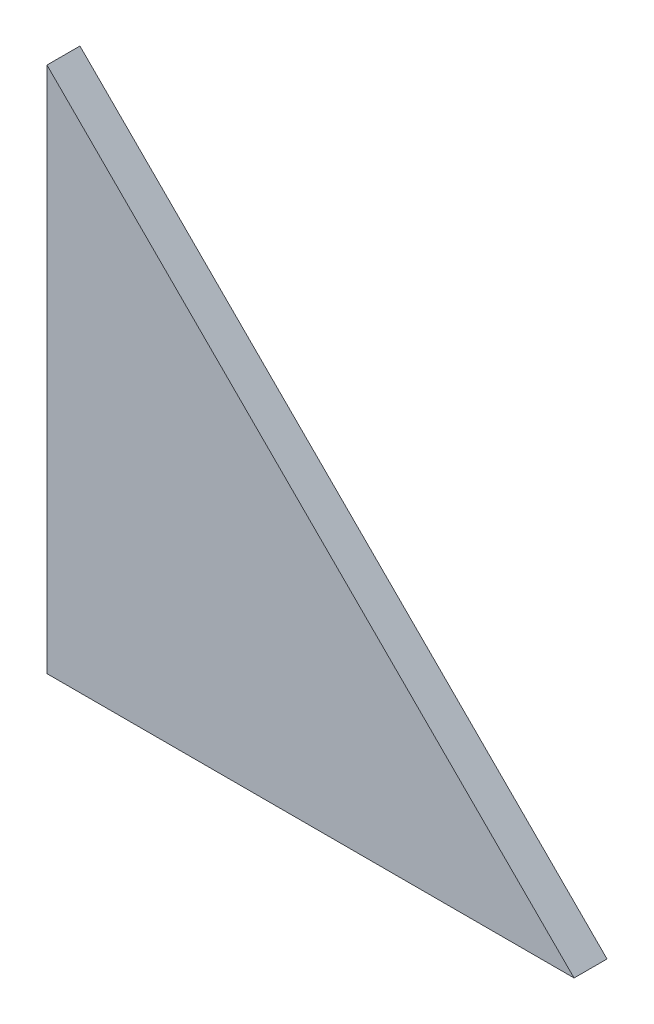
SolidWorks part; units mm, degrees
ref_plane "Front Plane" through (0, 0, 0) normal (0, 0, 1) x (1, 0, 0)
ref_plane "Top Plane" through (0, 0, 0) normal (0, 1, 0) x (1, 0, 0)
ref_plane "Right Plane" through (0, 0, 0) normal (1, 0, 0) x (0, 0, -1)
sketch "Sketch1" plane through (0, 0, 0) normal (0, 0, 1) x (1, 0, 0)
  line L0 (0, 0) -> (101.6, 0)
  line L1 (101.6, 0) -> (0, 101.6)
  line L2 (0, 101.6) -> (0, 0)
  dimension "D1" = 45
  dimension "D2" = 101.6
extrude "Boss-Extrude1" add sketch "Sketch1" along normal blind 6.35
